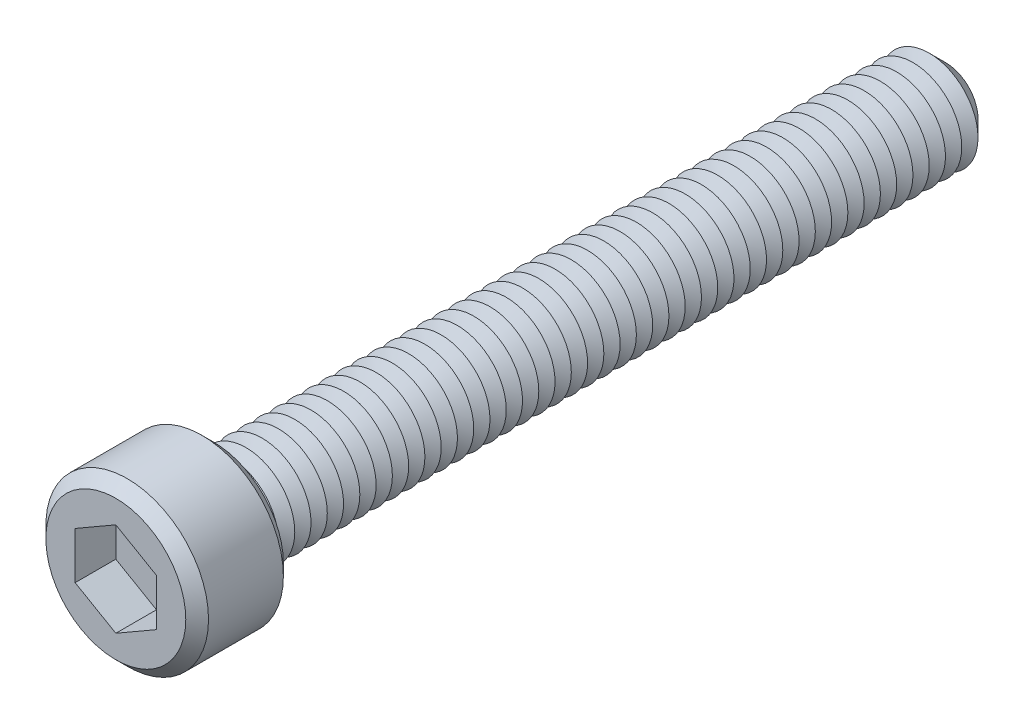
SolidWorks part; units mm, degrees
ref_plane "Front Plane" through (0, 0, 0) normal (0, 0, 1) x (1, 0, 0)
ref_plane "Top Plane" through (0, 0, 0) normal (0, 1, 0) x (1, 0, 0)
ref_plane "Right Plane" through (0, 0, 0) normal (1, 0, 0) x (0, 0, -1)
sketch "Sketch1" plane through (0, 0, 0) normal (0, 0, 1) x (1, 0, 0)
  circle A0 centre (0, 0) radius 5
  dimension "D1" = 10
extrude "Boss-Extrude1" add sketch "Sketch1" along normal blind 6
sketch "Sketch2" plane through (0, 0, 0) normal (0, 0, -1) x (-1, 0, 0)
  circle A0 centre (0, 0) radius 3
  dimension "D1" = 6
extrude "Boss-Extrude2" add sketch "Sketch2" along normal blind 45
chamfer "Chamfer1" distance 1 angle 45 1 edges at (-3, 0, -45)
sketch "Sketch3" plane through (0, 0, 0) normal (1, 0, 0) x (0, 0, -1)
  line L0 (-2.5121, 0) -> (4.5776, 0) construction
sketch "Sketch4" plane through (0, 0, 0) normal (1, 0, 0) x (0, 0, -1)
  line L0 (0, 3) -> (0.5, 2.134)
  line L1 (0.5, 2.134) -> (1, 3)
  line L2 (44, 3) -> (0, 3) construction
  line L3 (1, 3) -> (0, 3)
  dimension "D1" = 1
revolve "Cut-Revolve1" cut sketch "Sketch4" angle 360 about L0
pattern_linear "LPattern1" count 44 spacing 1 along (0, 0, -1) of "Cut-Revolve1"
sketch "Sketch5" plane through (0, 0, 6) normal (0, 0, 1) x (1, 0, 0)
  line L1 (0, 2.8868) -> (-2.5, 1.4434)
  line L2 (-2.5, 1.4434) -> (-2.5, -1.4434)
  line L3 (-2.5, -1.4434) -> (0, -2.8868)
  line L4 (0, -2.8868) -> (2.5, -1.4434)
  line L5 (2.5, -1.4434) -> (2.5, 1.4434)
  line L6 (2.5, 1.4434) -> (0, 2.8868)
  circle A0 centre (0, 0) radius 2.5 construction
  dimension "D1" = 5
extrude "Cut-Extrude1" cut sketch "Sketch5" against normal blind 2.5
sketch "Sketch6" plane through (0, 0, 3.5) normal (0, 0, 1) x (1, 0, 0)
  circle A0 centre (0, 0) radius 0.8
  dimension "D1" = 1.6
extrude "Cut-Extrude2" cut sketch "Sketch6" against normal up to surface (48.5 mm away)
chamfer "Chamfer2" distance 0.7 angle 45 2 edges at (5, 0, 0) (5, 0, 6)
